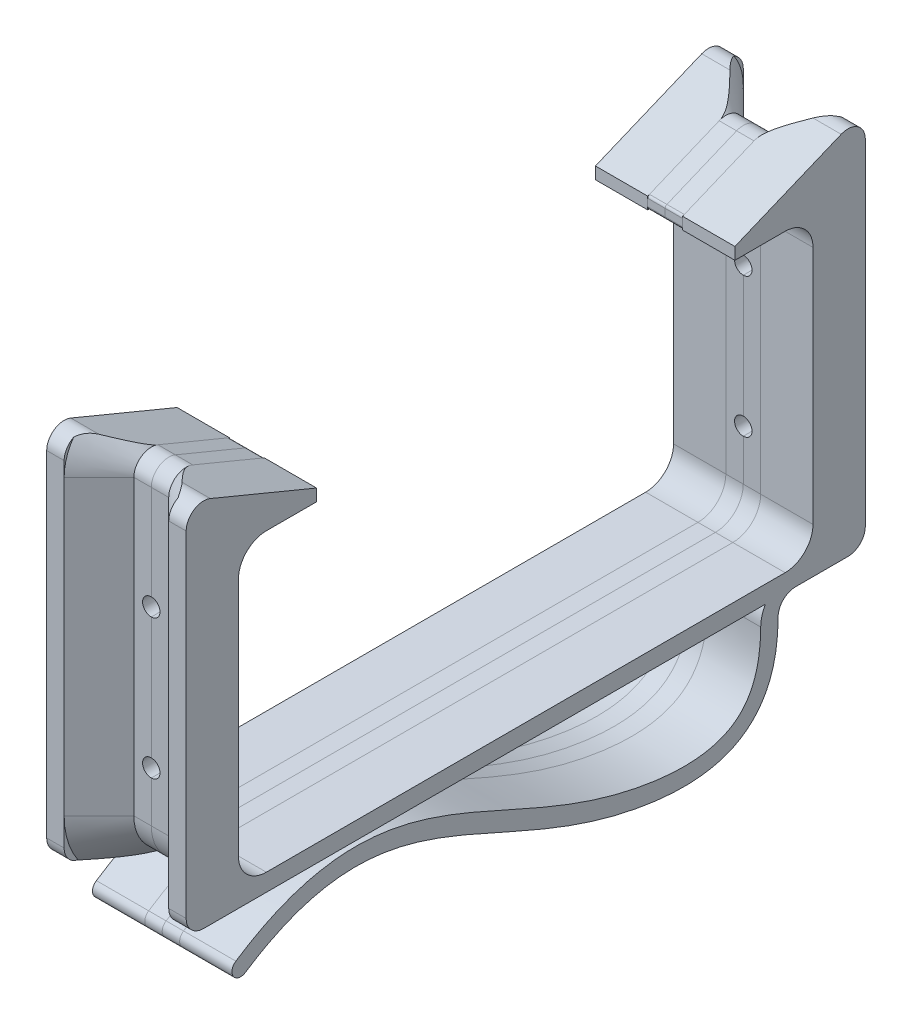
SolidWorks part; units mm, degrees
other "Markup1"
sketch "Sketch7" plane through (-12.7, 17.7179, -30.1625) normal (-0.2414, 0.8298, -0.5031) x (-0.9244, -0.0389, 0.3793)
ref_plane "Front Plane" through (0, 0, 0) normal (0, 0, 1) x (1, 0, 0)
ref_plane "Top Plane" through (0, 0, 0) normal (0, 1, 0) x (1, 0, 0)
ref_plane "Right Plane" through (0, 0, 0) normal (1, 0, 0) x (0, 0, -1)
sketch "Sketch1" plane through (0, 0, 0) normal (1, 0, 0) x (0, 0, -1)
  line L0 (-23.622, -13.462) -> (23.622, -13.462)
  line L1 (-26.162, -10.922) -> (-26.162, 10.922)
  line L2 (-23.622, 13.462) -> (23.622, 13.462)
  line L3 (26.162, -10.922) -> (26.162, 10.922)
  line L4 (-26.162, -13.462) -> (26.162, 13.462) construction
  line L5 (-26.162, 13.462) -> (26.162, -13.462) construction
  arc A0 (-23.622, -13.462) -> (-26.162, -10.922) centre (-23.622, -10.922) cw
  arc A1 (23.622, -13.462) -> (26.162, -10.922) centre (23.622, -10.922) ccw
  arc A2 (23.622, 13.462) -> (26.162, 10.922) centre (23.622, 10.922) cw
  arc A3 (-26.162, 10.922) -> (-23.622, 13.462) centre (-23.622, 10.922) cw
  point P0 (0, 0)
  dimension "D3" = 2.54
  dimension "D1" = 52.324
  dimension "D2" = 26.924
extrude "Extrude-Thin1" add sketch "Sketch1" along normal mid plane 12.7 thin
sketch "Sketch2" plane through (6.35, 0, 0) normal (1, 0, 0) x (0, 0, -1)
  line L0 (23.622, 13.462) -> (-23.622, 13.462) construction
  line L1 (-19.05, 13.462) -> (19.05, 13.462)
  line L2 (-19.05, 13.462) -> (-19.05, 15.0495)
  line L3 (-19.05, 15.0495) -> (19.05, 15.0495)
  line L4 (19.05, 13.462) -> (19.05, 15.0495)
  line L5 (23.622, 15.0495) -> (-23.622, 15.0495) construction
  point P8 (0, 13.462)
  dimension "D1" = 38.1
extrude "Cut-Extrude1" cut sketch "Sketch2" against normal through all
sketch "Sketch3" plane through (6.35, 0, 0) normal (1, 0, 0) x (0, 0, -1)
  line L0 (-27.7495, 10.922) -> (-27.7495, 19.812)
  line L1 (-27.7495, 19.812) -> (-19.05, 19.812)
  line L2 (-19.05, 19.812) -> (-19.05, 13.462)
  line L3 (27.7495, 10.922) -> (27.7495, 19.812)
  line L4 (27.7495, 19.812) -> (19.05, 19.812)
  line L5 (19.05, 19.812) -> (19.05, 13.462)
  line L6 (-19.05, 15.0495) -> (-19.05, 13.462) construction
  line L7 (19.05, 13.462) -> (19.05, 15.0495) construction
  line L8 (-19.05, 13.462) -> (-23.622, 13.462) construction
  line L9 (23.622, 15.0495) -> (19.05, 15.0495) construction
  line L10 (-19.05, 15.0495) -> (-23.622, 15.0495) construction
  line L11 (23.622, 15.0495) -> (19.05, 15.0495)
  line L12 (-19.05, 15.0495) -> (-23.622, 15.0495)
  arc A0 (27.7495, 10.922) -> (23.622, 15.0495) centre (23.622, 10.922) ccw construction
  arc A1 (-23.622, 15.0495) -> (-27.7495, 10.922) centre (-23.622, 10.922) ccw construction
  arc A2 (27.7495, 10.922) -> (23.622, 15.0495) centre (23.622, 10.922) ccw
  arc A3 (-23.622, 15.0495) -> (-27.7495, 10.922) centre (-23.622, 10.922) ccw
  dimension "D1" = 6.35
extrude "Boss-Extrude1" add sketch "Sketch3" against normal through all contours L2 L1 L0 M8 M7 | L4 L5 L3 M15 M14
chamfer "Chamfer1" distance 12.7 angle 22.5 2 edges at (0, 19.812, -19.05) (0, 19.812, 19.05)
sketch "Sketch4" plane through (6.35, 0, 0) normal (1, 0, 0) x (0, 0, -1)
  line L0 (-27.7495, 18.1549) -> (-30.9245, 19.4701)
  line L1 (-27.7495, 18.1549) -> (-27.7495, -10.922) construction
  line L2 (-19.05, 14.5515) -> (-27.7495, 18.1549) construction
  line L3 (-30.9245, 19.4701) -> (-30.9245, -15.0495)
  line L4 (-30.9245, -15.0495) -> (-23.622, -15.0495)
  line L5 (-23.622, -15.0495) -> (23.622, -15.0495) construction
  line L6 (-26.162, 10.922) -> (-26.162, -10.922) construction
  line L7 (0, 0) -> (0, -13.462) construction
  line L8 (-23.622, -13.462) -> (23.622, -13.462) construction
  line L9 (-27.7495, 18.1549) -> (-27.7495, -10.922)
  line L10 (27.7495, 18.1549) -> (27.7495, -10.922)
  line L11 (30.9245, -15.0495) -> (23.622, -15.0495)
  line L12 (30.9245, 19.4701) -> (30.9245, -15.0495)
  line L13 (27.7495, 18.1549) -> (30.9245, 19.4701)
  arc A0 (-27.7495, -10.922) -> (-23.622, -15.0495) centre (-23.622, -10.922) ccw construction
  arc A1 (-27.7495, -10.922) -> (-23.622, -15.0495) centre (-23.622, -10.922) ccw
  arc A2 (27.7495, -10.922) -> (23.622, -15.0495) centre (23.622, -10.922) cw
  dimension "D1" = 4.7625
extrude "Boss-Extrude2" add sketch "Sketch4" against normal blind 1.5875 contours L3 L4 L0 M27 M26 | L13 L11 L12 M12 M29
mirror "Mirror1" about plane through (0, 0, 0) normal (1, 0, 0) of "Boss-Extrude2"
fillet "Fillet1" radius 1.5875 10 edges at (0, 18.1549, 27.7495) (5.5562, -15.0495, 30.9245) (5.5562, 19.4701, 30.9245) (5.5562, 19.4701, -30.9245) (5.5562, -15.0495, -30.9245) (-5.5562, 19.4701, 30.9245) (-5.5562, -15.0495, 30.9245) (0, 18.1549, -27.7495) (-5.5562, 19.4701, -30.9245) (-5.5562, -15.0495, -30.9245)
sketch "Sketch5" plane through (6.35, 0, 0) normal (1, 0, 0) x (0, 0, -1)
  line L0 (-29.337, -15.0495) -> (29.337, -15.0495) construction
  line L2 (26.162, -10.922) -> (26.162, 10.922) construction
  line L6 (-26.162, 10.922) -> (-26.162, -10.922) construction
  arc A0 (24.5745, -15.0495) -> (22.987, -16.637) centre (24.5745, -16.637) ccw
  spline S0 degree 3 poles (22.987, -16.637) (22.987, -25.8704) (-0.5857, -27.5815) (-12.3512, -11.1577) (-26.162, -20.8467) knots 0 0 0 0 0.28086 1 1 1 1
  dimension "D1" = 1.5875
  dimension "D2" = 1.5875
extrude "Extrude-Thin2" add sketch "Sketch5" against normal through all thin
fillet "Fillet2" radius 0.7935 2 edges at (0, -20.8467, 26.162) (0, -19.5471, 27.0737)
chamfer "Chamfer2" distance 3.175 angle 45 12 edges at (4.7625, -13.4818, -26.8599) (4.7625, 17.099, -27.044) (4.7625, 2.4285, -27.7495) (-4.7625, -13.4818, -26.8599) (-4.7625, 17.099, -27.044) (-4.7625, 2.4285, -27.7495) (4.7625, 17.099, 27.044) (4.7625, -13.8406, 26.5406) (4.7625, 2.4285, 27.7495) (-4.7625, 17.099, 27.044) (-4.7625, -13.8406, 26.5406) (-4.7625, 2.4285, 27.7495)
sketch "Sketch6" plane through (0, 0, 0) normal (0, 0, 1) x (1, 0, 0)
  line L0 (0, -6.35) -> (0, 6.35) construction
  line L1 (0, 6.35) -> (0, 13.462) construction
  line L3 (0, -6.35) -> (0, -13.462) construction
  line L5 (6.35, -13.462) -> (-6.35, -13.462) construction
  line L6 (6.35, 13.462) -> (-6.35, 13.462) construction
  circle A0 centre (0, 6.35) radius 0.7937
  circle A1 centre (0, -6.35) radius 0.7937
  dimension "D1" = 1.5875
  dimension "D2" = 12.7
extrude "Cut-Extrude2" cut sketch "Sketch6" against normal through all both and the other way through all
ref_plane "Plane1" through (1.5875, 0, 0) normal (1, 0, 0) x (0, 0, -1)
ref_plane "Plane2" through (-1.5875, 0, 0) normal (1, 0, 0) x (0, 0, -1)
split "Split1" trim tools "Right Plane", "Plane2", "Plane1" bodies to split 107 resulting bodies 115 116 117 118
fillet "Fillet3" radius 0.254 4 edges at (-0.7938, 14.5515, -19.05) (-0.7938, 13.462, -19.05) (-0.7938, 14.5515, 19.05) (-0.7938, 13.462, 19.05)
fillet "Fillet4" radius 0.254 4 edges at (0.7938, 14.5515, 19.05) (0.7938, 13.462, 19.05) (0.7938, 14.5515, -19.05) (0.7938, 13.462, -19.05)
equation "\"0.031i2n\"=0.031"
